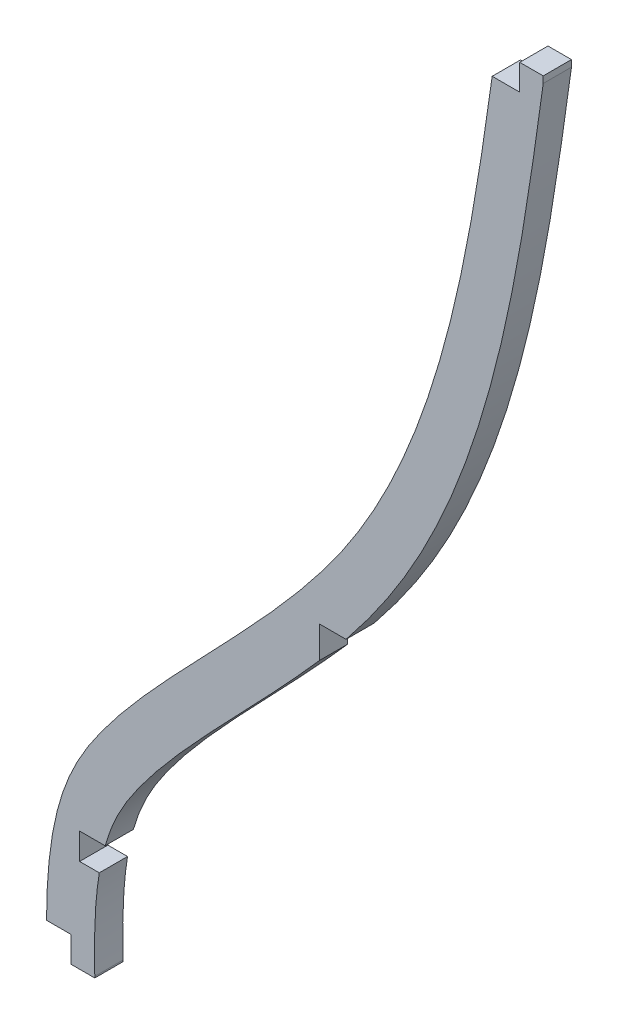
SolidWorks part; units mm, degrees
ref_plane "Front Plane" through (0, 0, 0) normal (0, 0, 1) x (1, 0, 0)
ref_plane "Top Plane" through (0, 0, 0) normal (0, 1, 0) x (1, 0, 0)
ref_plane "Right Plane" through (0, 0, 0) normal (1, 0, 0) x (0, 0, -1)
sketch "Sketch2" plane through (0, 0, 0) normal (0, 0, 1) x (1, 0, 0)
  line L0 (0, 0) -> (0, 106.68) construction
  line L1 (0, 0) -> (-76.2, 0) construction
  line L2 (0, 106.68) -> (-28.575, 106.68) construction
  line L3 (0, 0) -> (0, 106.68) construction
  line L4 (-75.27, 12.7) -> (0, 12.7) construction
  line L5 (-51.0976, 44.45) -> (0, 44.45) construction
  line L6 (-71.1223, 0.1523) -> (-71.1223, 0)
  line L7 (-71.1223, 0) -> (-76.2, 0)
  line L8 (-28.575, 106.68) -> (-23.5432, 106.68)
  line L10 (-23.5432, 105.9822) -> (-23.5432, 106.68)
  spline S0 degree 3 poles (-76.2, 0) (-76.5697, 12.3264) (-70.4254, 26.7635) (-35.695, 54.9593) (-31.1223, 88.3123) (-28.575, 106.68) knots 0 0 0 0 0.192928 0.526147 1 1 1 1
  spline S1 degree 1 poles (-71.1223, 0.1523) (-23.5432, 105.9822) knots 0 0 1 1 construction
  spline S2 degree 3 poles (-71.1223, 0.1523) (-71.1361, 0.6121) (-71.1567, 1.5498) (-71.1646, 3.2821) (-71.1168, 5.2862) (-70.9731, 7.4216) (-70.6767, 9.951) (-70.1306, 12.5718) (-69.2454, 15.1046) (-68.1202, 17.3344) (-66.6722, 19.5511) (-64.8631, 21.9349) (-62.1184, 25.2082) (-58.1372, 29.5028) (-52.8597, 34.9642) (-47.4482, 40.7915) (-42.2515, 47.0605) (-37.6918, 53.9253) (-34.0642, 61.0843) (-31.1698, 68.4658) (-28.9001, 75.9825) (-27.1227, 83.5631) (-25.7154, 91.1411) (-24.7522, 97.394) (-24.0486, 102.3357) (-23.7122, 104.7629) (-23.5432, 105.9822) knots 0 0 0 0 0.007812 0.015625 0.03125 0.046875 0.0625 0.09375 0.125 0.15625 0.1875 0.21875 0.25 0.3125 0.375 0.4375 0.5 0.5625 0.625 0.6875 0.75 0.8125 0.875 0.9375 0.96875 1 1 1 1
  dimension "D1" = 106.68
  dimension "D2" = 28.575
  dimension "D3" = 76.2
  dimension "D4" = 12.7
  dimension "D5" = 44.45
  dimension "D6" = 75.27
  dimension "D7" = 51.0976
  dimension "D8" = 5.08
extrude "Boss-Extrude1" add sketch "Sketch2" along normal blind 2.9972
sketch "Sketch3" plane through (0, 0, 2.9972) normal (0, 0, 1) x (1, 0, 0)
  line L0 (-73.66, 0) -> (-73.66, 2.7432)
  line L1 (-71.1223, 0) -> (-76.2, 0) construction
  line L2 (-73.66, 2.7432) -> (-76.2391, 2.7432)
  line L3 (-73.66, 0) -> (-76.5672, 0)
  line L4 (-76.5672, 0) -> (-76.2391, 2.7432)
  line L5 (-70.0285, 12.7) -> (-72.73, 12.7)
  line L6 (-75.27, 12.7) -> (0, 12.7) construction
  line L7 (-72.73, 12.7) -> (-72.73, 9.906)
  line L8 (-72.73, 9.906) -> (-70.643, 9.906)
  line L9 (-70.643, 9.906) -> (-70.0285, 12.7)
  line L10 (-44.4594, 44.45) -> (-47.2876, 44.45)
  line L11 (-51.0976, 44.45) -> (0, 44.45) construction
  line L12 (-47.2876, 44.45) -> (-47.2876, 41.0895)
  line L13 (-47.2876, 41.0895) -> (-44.4594, 41.0895)
  line L14 (-44.4594, 41.0895) -> (-44.4594, 44.45)
  line L15 (-26.035, 106.68) -> (-26.035, 103.9368)
  line L16 (-28.575, 106.68) -> (-23.5432, 106.68) construction
  line L17 (-26.035, 103.9368) -> (-28.9563, 103.9368)
  line L18 (-28.9563, 103.9368) -> (-28.9563, 106.68)
  line L19 (-28.9563, 106.68) -> (-26.035, 106.68)
  spline S0 degree 3 poles (-76.2, 0) (-76.5697, 12.3264) (-70.4254, 26.7635) (-35.695, 54.9593) (-31.1223, 88.3123) (-28.575, 106.68) knots 0 0 0 0 0.192928 0.526147 1 1 1 1 construction
  spline S1 degree 3 poles (-71.1223, 0.1523) (-71.1361, 0.6121) (-71.1567, 1.5498) (-71.1646, 3.2821) (-71.1168, 5.2862) (-70.9731, 7.4216) (-70.6767, 9.951) (-70.1306, 12.5718) (-69.2454, 15.1046) (-68.1202, 17.3344) (-66.6722, 19.5511) (-64.8631, 21.9349) (-62.1184, 25.2082) (-58.1372, 29.5028) (-52.8597, 34.9642) (-47.4482, 40.7915) (-42.2515, 47.0605) (-37.6918, 53.9253) (-34.0642, 61.0843) (-31.1698, 68.4658) (-28.9001, 75.9825) (-27.1227, 83.5631) (-25.7154, 91.1411) (-24.7522, 97.394) (-24.0486, 102.3357) (-23.7122, 104.7629) (-23.5432, 105.9822) knots 0 0 0 0 0.007812 0.015625 0.03125 0.046875 0.0625 0.09375 0.125 0.15625 0.1875 0.21875 0.25 0.3125 0.375 0.4375 0.5 0.5625 0.625 0.6875 0.75 0.8125 0.875 0.9375 0.96875 1 1 1 1 construction
  dimension "D1" = 2.54
  dimension "D2" = 2.7432
  dimension "D3" = 2.54
  dimension "D4" = 2.794
  dimension "D5" = 3.81
  dimension "D6" = 2.54
  dimension "D7" = 2.7432
extrude "Cut-Extrude1" cut sketch "Sketch3" against normal blind 2.9972
